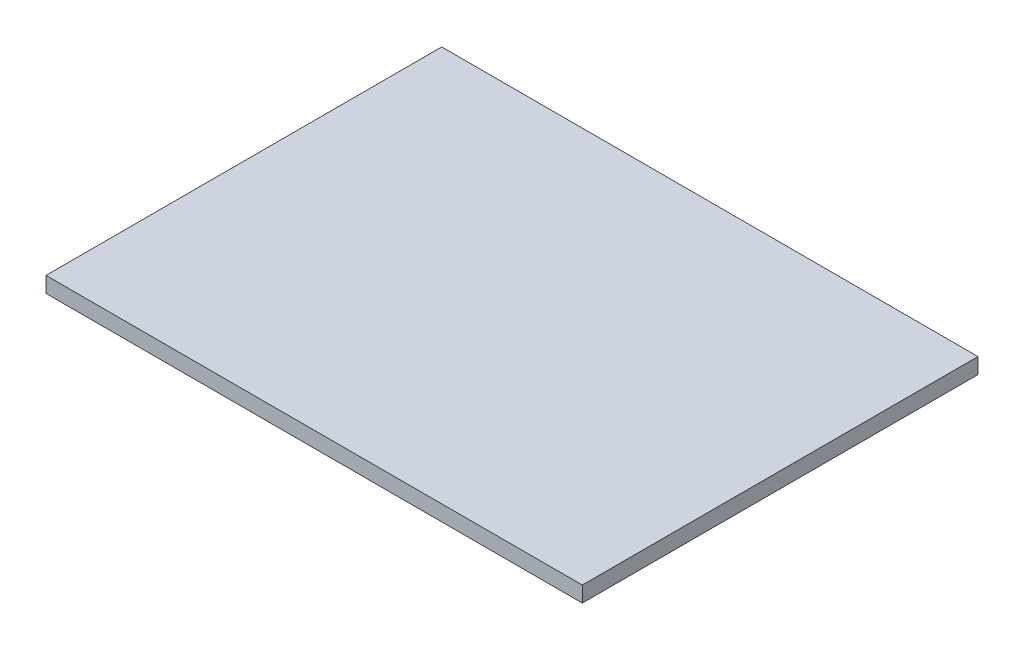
SolidWorks part; units mm, degrees
ref_plane "Front Plane" through (0, 0, 0) normal (0, 0, 1) x (1, 0, 0)
ref_plane "Top Plane" through (0, 0, 0) normal (0, 1, 0) x (1, 0, 0)
ref_plane "Right Plane" through (0, 0, 0) normal (1, 0, 0) x (0, 0, -1)
sketch "Sketch1" plane through (0, 0, 0) normal (0, 1, 0) x (1, 0, 0)
  line L1 (-327.025, 241.3) -> (327.025, 241.3)
  line L2 (-327.025, 241.3) -> (-327.025, -241.3)
  line L3 (-327.025, -241.3) -> (327.025, -241.3)
  line L4 (327.025, 241.3) -> (327.025, -241.3)
  line L5 (-327.025, 241.3) -> (327.025, -241.3) construction
  line L6 (-327.025, -241.3) -> (327.025, 241.3) construction
  point P0 (0, 0)
  dimension "D1" = 654.05
  dimension "D2" = 482.6
extrude "Boss-Extrude1" add sketch "Sketch1" along normal mid plane 19.05
